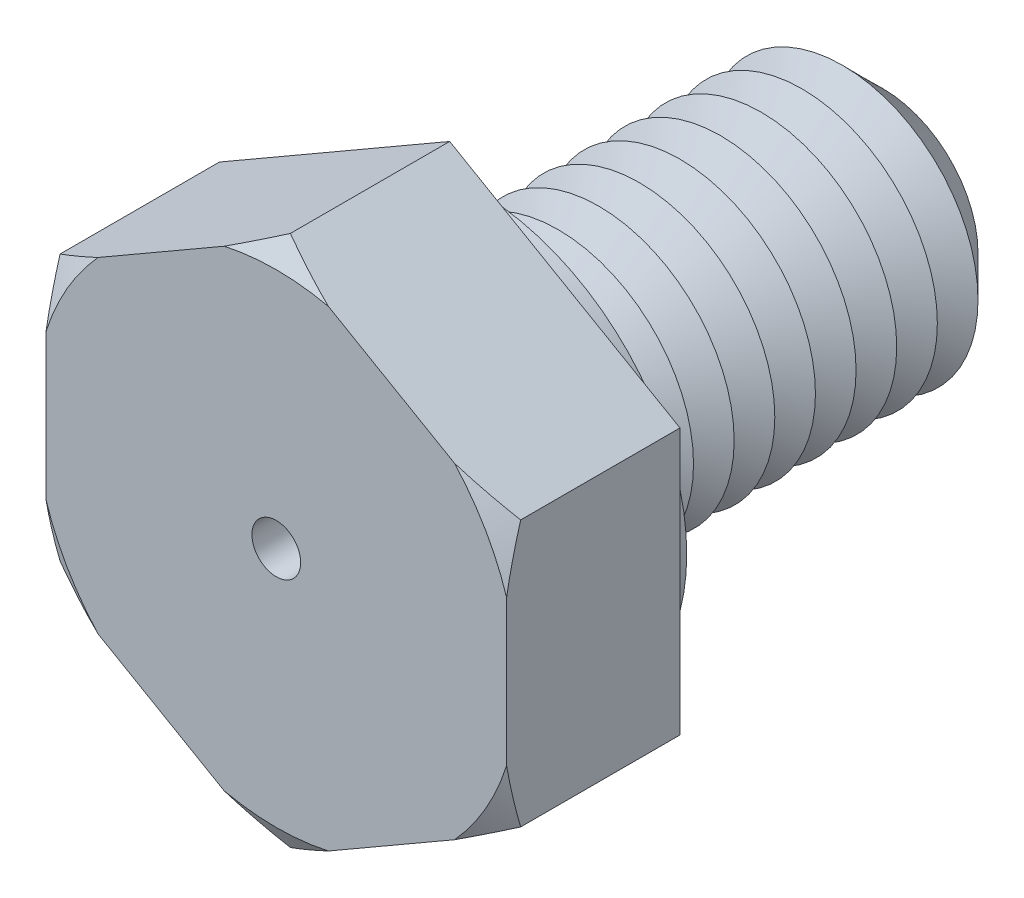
SolidWorks part; units mm, degrees
ref_plane "Front Plane" through (0, 0, 0) normal (0, 0, 1) x (1, 0, 0)
ref_plane "Top Plane" through (0, 0, 0) normal (0, 1, 0) x (1, 0, 0)
ref_plane "Right Plane" through (0, 0, 0) normal (1, 0, 0) x (0, 0, -1)
sketch "Sketch2" plane through (0, 0, 0) normal (0, 0, 1) x (1, 0, 0)
  line L1 (0, 9.815) -> (-8.5, 4.9075)
  line L2 (-8.5, 4.9075) -> (-8.5, -4.9075)
  line L3 (-8.5, -4.9075) -> (0, -9.815)
  line L4 (0, -9.815) -> (8.5, -4.9075)
  line L5 (8.5, -4.9075) -> (8.5, 4.9075)
  line L6 (8.5, 4.9075) -> (0, 9.815)
  circle A0 centre (0, 0) radius 8.5 construction
  dimension "D1" = 17
extrude "Boss-Extrude1" add sketch "Sketch2" along normal blind 6.4
sketch "Sketch3" plane through (0, 0, 0) normal (0, 0, -1) x (-1, 0, 0)
  circle A0 centre (0, 0) radius 5
  dimension "D1" = 10
extrude "Boss-Extrude2" add sketch "Sketch3" along normal blind 16
sketch "Sketch4" plane through (0, 0, 0) normal (0, 0, -1) x (-1, 0, 0)
  circle A0 centre (0, 0) radius 7.75
  dimension "D1" = 15.5
extrude "Boss-Extrude3" add sketch "Sketch4" along normal blind 1
sketch "Sketch5" plane through (0, 0, 0) normal (1, 0, 0) x (0, 0, -1)
  line L0 (-3.2117, 0) -> (6.3192, 0) construction
chamfer "Chamfer1" distance 1.5 angle 45 1 edges at (-5, 0, -16)
sketch "Sketch6" plane through (0, 0, 0) normal (1, 0, 0) x (0, 0, -1)
  line L0 (1, 5) -> (1.75, 3.701)
  line L1 (1.75, 3.701) -> (2.5, 5)
  line L2 (14.5, 5) -> (1, 5) construction
  line L3 (2.5, 5) -> (1, 5)
  dimension "D1" = 1.5
revolve "Cut-Revolve1" cut sketch "Sketch6" angle 360 about L0
pattern_linear "LPattern1" count 9 spacing 1.5 along (0, 0, -1) of "Cut-Revolve1"
sketch "Sketch7" plane through (0, 0, 0) normal (1, 0, 0) x (0, 0, -1)
  line L0 (-6.4, 9.815) -> (-6.4, 8.915)
  line L1 (-6.4, 4.9075) -> (-6.4, 9.815) construction
  line L2 (-6.4, 8.915) -> (-5.8804, 9.815)
  line L3 (-6.4, 9.815) -> (0, 9.815) construction
  line L4 (-5.8804, 9.815) -> (-6.4, 9.815)
  dimension "D1" = 0.9
  dimension "D2" = 30
revolve "Cut-Revolve2" cut sketch "Sketch7" angle 360 about L0
sketch "Sketch8" plane through (0, 0, 6.4) normal (0, 0, 1) x (1, 0, 0)
  circle A0 centre (0, 0) radius 0.9
  dimension "D1" = 1.8
extrude "Cut-Extrude1" cut sketch "Sketch8" against normal up to surface (22.4 mm away)
